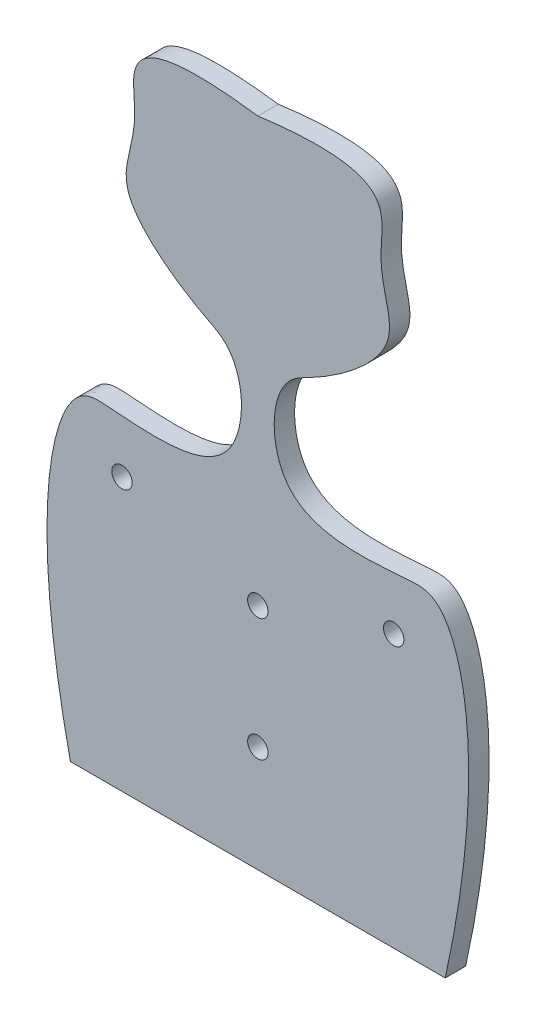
SolidWorks part; units mm, degrees
ref_plane "Front Plane" through (0, 0, 0) normal (0, 0, 1) x (1, 0, 0)
ref_plane "Top Plane" through (0, 0, 0) normal (0, 1, 0) x (1, 0, 0)
ref_plane "Right Plane" through (0, 0, 0) normal (1, 0, 0) x (0, 0, -1)
sketch "Sketch1" plane through (0, 0, 0) normal (0, 0, 1) x (1, 0, 0)
  line L0 (0, 0) -> (0, 101.6) construction
  line L1 (-29.1666, 0) -> (29.1666, 0)
  circle A0 centre (-21.1457, 42.3709) radius 1.5875
  circle A1 centre (21.1457, 42.3709) radius 1.5875
  circle A2 centre (0, 35.6009) radius 1.5875
  circle A3 centre (0, 16.5509) radius 1.5875
  spline S0 degree 3 poles (0, 101.6) (-18.8728, 104.1324) (-19.6316, 98.338) (-18.6358, 87.6878) (-23.8532, 81.8796) (-12.5671, 72.4731) (-1.8963, 67.4471) (-1.6568, 48.4832) (-18.7049, 50.5698) (-31.5237, 51.2246) (-35.7628, 30.0088) (-29.1666, 0) knots 0 0 0 0 0.125637 0.160475 0.348383 0.494673 0.524046 0.642117 0.813384 0.849173 1 1 1 1
  spline S1 degree 3 poles (0, 101.6) (18.8728, 104.1324) (19.6316, 98.338) (18.6358, 87.6878) (23.8532, 81.8796) (12.5671, 72.4731) (1.8963, 67.4471) (1.6568, 48.4832) (18.7049, 50.5698) (31.5237, 51.2246) (35.7628, 30.0088) (29.1666, 0) knots 0 0 0 0 0.125637 0.160475 0.348383 0.494673 0.524046 0.642117 0.813384 0.849173 1 1 1 1
  point P23 (0, 0)
  dimension "D2" = 3.175
  dimension "D1" = 101.6
  dimension "D3" = 19.05
extrude "Boss-Extrude1" add sketch "Sketch1" along normal blind 3.175
